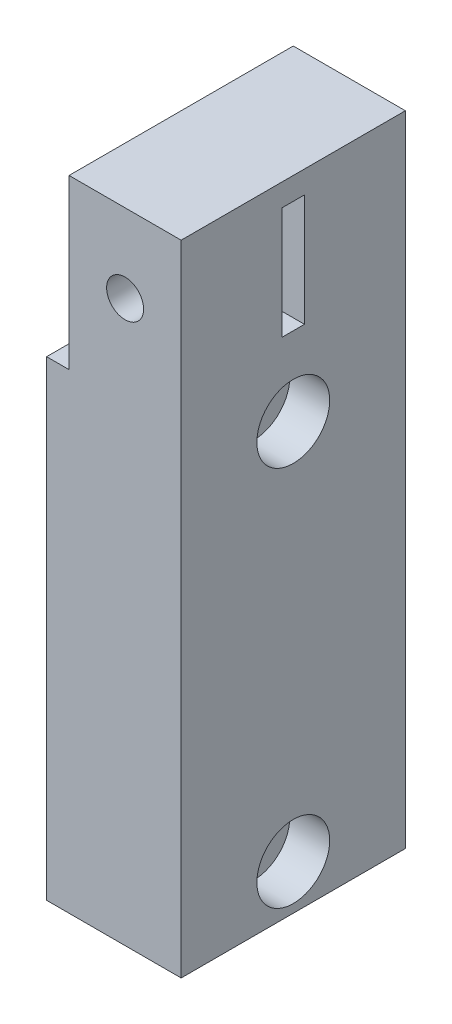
SolidWorks part; units mm, degrees
ref_plane "前视基准面" through (0, 0, 0) normal (0, 0, 1) x (1, 0, 0)
ref_plane "上视基准面" through (0, 0, 0) normal (0, 1, 0) x (1, 0, 0)
ref_plane "右视基准面" through (0, 0, 0) normal (1, 0, 0) x (0, 0, -1)
sketch "草图1" plane through (0, 0, 0) normal (0, 0, 1) x (1, 0, 0)
  line L0 (12, 0) -> (12, 57)
  line L1 (2, 42) -> (2, 57)
  line L2 (0, 0) -> (0, 42)
  line L3 (2, 57) -> (12, 57)
  line L4 (0, 0) -> (12, 0)
  line L5 (0, 42) -> (2, 42)
extrude "凸台-拉伸1" add sketch "草图1" along normal blind 20
sketch "草图2" plane through (12, 0, 0) normal (1, 0, 0) x (0, 0, -1)
  line L0 (-20, 0) -> (-20, 57)
  line L1 (0, 0) -> (0, 57)
  line L2 (-20, 57) -> (0, 57)
  line L3 (-20, 0) -> (0, 0)
  line L4 (-11, 45) -> (-9, 45)
  line L5 (-11, 55) -> (-9, 55)
  line L6 (-11, 45) -> (-11, 55)
  line L7 (-9, 45) -> (-9, 55)
  circle A0 centre (-10, 38) radius 1.75
  circle A1 centre (-10, 4) radius 1.75
extrude "切除-拉伸1" cut sketch "草图2" against normal blind 20 flip side to cut
sketch "草图3" plane through (12, 0, 0) normal (1, 0, 0) x (0, 0, -1)
  circle A0 centre (-10, 38) radius 3.25
  circle A1 centre (-10, 4) radius 3.25
extrude "切除-拉伸2" cut sketch "草图3" against normal blind 3.56
sketch "草图4" plane through (0, 57, 0) normal (0, 1, 0) x (1, 0, 0)
  line L0 (0, -2) -> (2, -2)
  line L1 (0, -18) -> (2, -18)
  line L2 (2, -18) -> (2, -2)
extrude "切除-拉伸3" cut sketch "草图4" against normal through all and the other way through all
sketch "草图5" plane through (0, 0, 20) normal (0, 0, 1) x (1, 0, 0)
  circle A0 centre (7, 50) radius 1.65
extrude "切除-拉伸4" cut sketch "草图5" against normal through all
